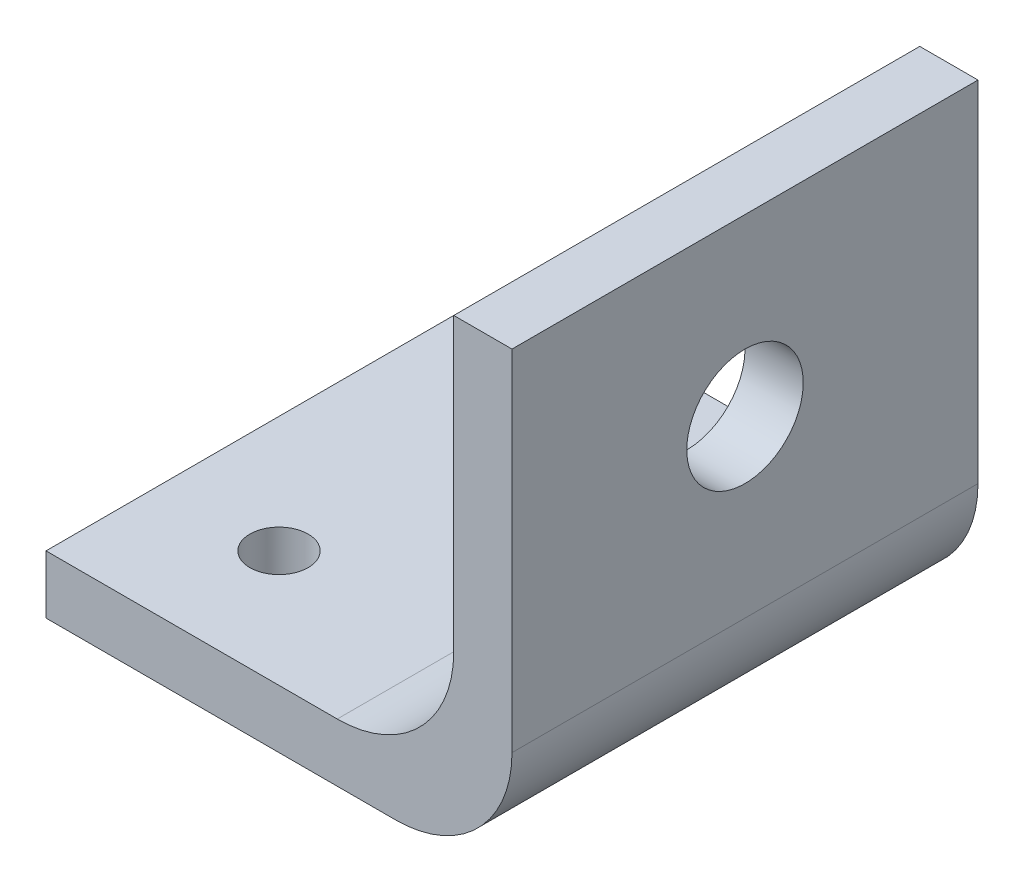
SolidWorks part; units mm, degrees
ref_plane "Front Plane" through (0, 0, 0) normal (0, 0, 1) x (1, 0, 0)
ref_plane "Top Plane" through (0, 0, 0) normal (0, 1, 0) x (1, 0, 0)
ref_plane "Right Plane" through (0, 0, 0) normal (1, 0, 0) x (0, 0, -1)
sketch "Sketch1" plane through (0, 0, 0) normal (0, 0, 1) x (1, 0, 0)
  line L1 (0, 0) -> (30, 0)
  line L2 (0, 0) -> (0, 5)
  line L3 (0, 5) -> (25, 5)
  line L6 (40, 10) -> (40, 40)
  line L7 (40, 40) -> (35, 40)
  line L8 (35, 15) -> (35, 40)
  arc A0 (40, 10) -> (30, 0) centre (30, 10) cw
  arc A1 (25, 5) -> (35, 15) centre (25, 15) ccw
  point P11 (40, 0)
  dimension "D5" = 10
  dimension "D1" = 40
  dimension "D2" = 40
  dimension "D3" = 5
  dimension "D4" = 5
extrude "Boss-Extrude1" add sketch "Sketch1" along normal blind 40 contours L3 A1 L8 L7 L6 A0 L1 L2
sketch "Sketch2" plane through (0, 0, 0) normal (0, -1, 0) x (1, 0, 0)
  line L0 (0, 20) -> (30, 20) construction
  line L1 (0, 40) -> (0, 0) construction
  line L2 (30, 40) -> (30, 0) construction
  line L3 (0, 0) -> (30, 0) construction
  circle A0 centre (10, 30) radius 2.5
  circle A1 centre (10, 10) radius 2.5
  dimension "D1" = 5
  dimension "D2" = 10
  dimension "D3" = 10
extrude "Cut-Extrude1" cut sketch "Sketch2" against normal blind 40
sketch "Sketch3" plane through (40, 0, 0) normal (1, 0, 0) x (0, 0, -1)
  line L0 (0, 10) -> (0, 40) construction
  line L1 (-40, 40) -> (0, 40) construction
  circle A0 centre (-20, 25) radius 5
  dimension "D1" = 10
  dimension "D2" = 20
  dimension "D3" = 15
extrude "Cut-Extrude2" cut sketch "Sketch3" against normal blind 40
